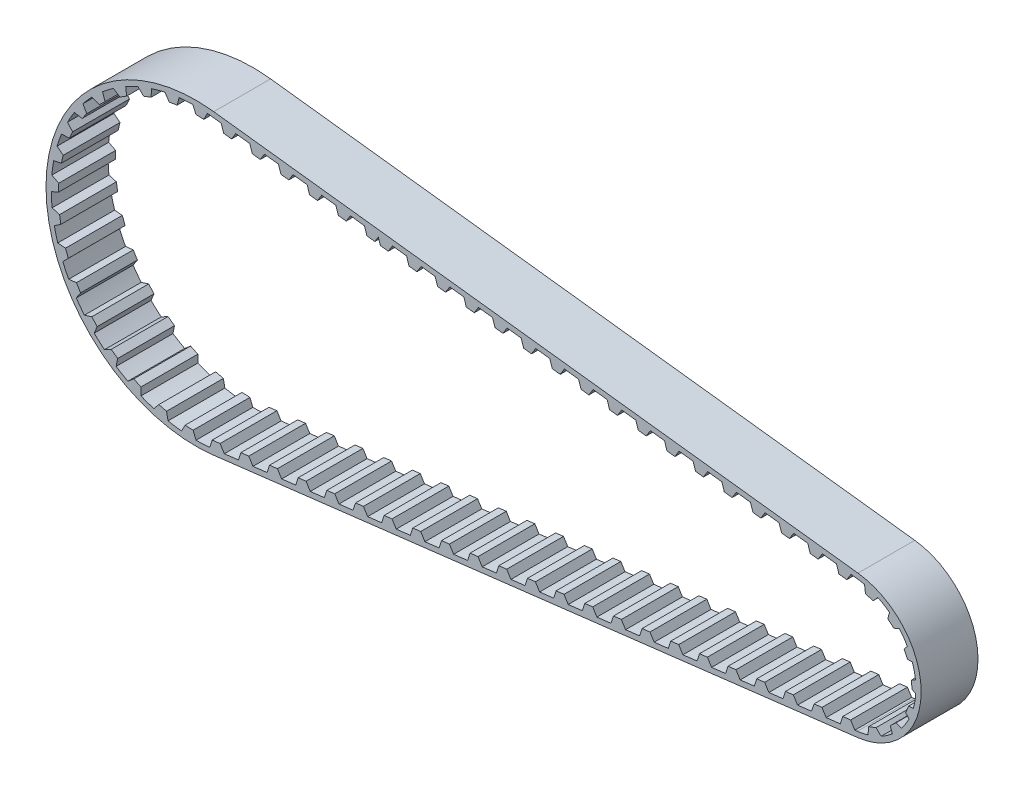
SolidWorks part; units mm, degrees
ref_plane "Face" through (0, 0, 0) normal (0, 0, 1) x (1, 0, 0)
ref_plane "Dessus" through (0, 0, 0) normal (0, 1, 0) x (1, 0, 0)
ref_plane "Droite" through (0, 0, 0) normal (1, 0, 0) x (0, 0, -1)
sketch "Esquisse1" plane through (0, 0, 0) normal (0, 0, 1) x (1, 0, 0)
  line L0 (3.0909, 25.6847) -> (116.4493, 12.0431) construction
  line L1 (3.0909, -25.6847) -> (116.4493, -12.0431) construction
  line L2 (0, 0) -> (115, 0) construction
  line L7 (7.3904, 24.7342) -> (116.3979, 11.6162)
  line L12 (3.1506, 26.1811) -> (116.509, 12.5395)
  line L13 (3.1506, -26.1811) -> (116.509, -12.5395)
  line L14 (3.0395, 25.2578) -> (7.3904, 24.7342)
  line L15 (3.0395, -25.2578) -> (116.3979, -11.6162)
  arc A0 (3.0909, 25.6847) -> (3.0909, -25.6847) centre (0, 0) ccw construction
  arc A1 (3.1506, 26.1811) -> (3.1506, -26.1811) centre (0, 0) ccw
  arc A2 (116.4493, -12.0431) -> (116.4493, 12.0431) centre (115, 0) ccw construction
  arc A3 (116.509, -12.5395) -> (116.509, 12.5395) centre (115, 0) ccw
  arc A4 (116.3979, -11.6162) -> (116.3979, 11.6162) centre (115, 0) ccw
  arc A5 (3.0395, 25.2578) -> (3.0395, -25.2578) centre (0, 0) ccw
  dimension "D1" = 51.74
  dimension "D2" = 24.26
  dimension "D3" = 115
  dimension "D9" = 0.5
  dimension "D10" = 0.5
  dimension "D11" = 0.5
  dimension "D12" = 0.5
  dimension "D13" = 0.93
extrude "Base-Extrusion" add sketch "Esquisse1" along normal blind 10.1
sketch "Esquisse2" plane through (0, 0, 10.1) normal (0, 0, 1) x (1, 0, 0)
  line L0 (33.3187, 21.6863) -> (32.881, 18.0492) construction
  line L1 (116.3979, 11.6162) -> (3.0395, 25.2578) construction
  line L2 (31.9241, 22.084) -> (32.4634, 20.4377)
  line L3 (32.4634, 20.4377) -> (33.8534, 20.2705)
  line L4 (33.8534, 20.2705) -> (34.7679, 21.7417)
  line L5 (31.9241, 22.084) -> (34.7679, 21.7417)
  dimension "D1" = 50
  dimension "D2" = 1.27
  dimension "D3" = 1.39
  dimension "D4" = 0.3
extrude "Boss.-Extru.2" add sketch "Esquisse2" against normal blind 10
sketch "Esquisse4" plane through (0, 0, 0) normal (0, 0, -1) x (-1, 0, 0)
  line L4 (-116.3262, -11.0205) -> (-2.9678, -24.6621)
  line L5 (-2.9678, 24.6621) -> (-116.3262, 11.0205)
  line L6 (-116.3262, -11.0205) -> (-2.9678, -24.6621)
  line L7 (-2.9678, 24.6621) -> (-116.3262, 11.0205)
  arc A4 (-2.9678, -24.6621) -> (-2.9678, 24.6621) centre (0, 0) ccw
  arc A5 (-116.3262, 11.0205) -> (-116.3262, -11.0205) centre (-115, 0) ccw
  arc A6 (-2.9678, -24.6621) -> (-2.9678, 24.6621) centre (0, 0) ccw
  arc A7 (-116.3262, 11.0205) -> (-116.3262, -11.0205) centre (-115, 0) ccw
  dimension "D1" = 0.6
sketch "Esquisse6"
  line L4 (3.1112, -25.8535) -> (116.4696, -12.2119)
  line L5 (116.4696, 12.2119) -> (3.1112, 25.8535)
  line L6 (3.1112, -25.8535) -> (116.4696, -12.2119)
  line L7 (116.4696, 12.2119) -> (3.1112, 25.8535)
  arc A4 (116.4696, -12.2119) -> (116.4696, 12.2119) centre (115, 0) ccw
  arc A5 (3.1112, 25.8535) -> (3.1112, -25.8535) centre (0, 0) ccw
  arc A6 (116.4696, -12.2119) -> (116.4696, 12.2119) centre (115, 0) ccw
  arc A7 (3.1112, 25.8535) -> (3.1112, -25.8535) centre (0, 0) ccw
  dimension "D1" = 1.2
pattern_curve "CrvPattern2" parameters "D1"=71, "D3"=5.08, "D2"=1, "D4"=50
sketch "Esquisse5" plane through (0, 0, 0) normal (0, 0, -1) x (-1, 0, 0)
  line L0 (-3.1506, -26.1811) -> (-116.509, -12.5395) construction
  line L1 (-116.509, 12.5395) -> (-3.1506, 26.1811) construction
  line L2 (-3.1506, -26.1811) -> (-116.509, -12.5395)
  line L3 (-116.509, 12.5395) -> (-3.1506, 26.1811)
  arc A0 (-3.1506, -26.1811) -> (-3.1506, 26.1811) centre (0, 0) ccw construction
  arc A1 (-116.509, 12.5395) -> (-116.509, -12.5395) centre (-115, 0) ccw construction
  arc A2 (-3.1506, -26.1811) -> (-3.1506, 26.1811) centre (0, 0) ccw
  arc A3 (-116.509, 12.5395) -> (-116.509, -12.5395) centre (-115, 0) ccw
extrude "Enlèv. mat.-Extru.1" cut sketch "Esquisse5" against normal blind 0.1
